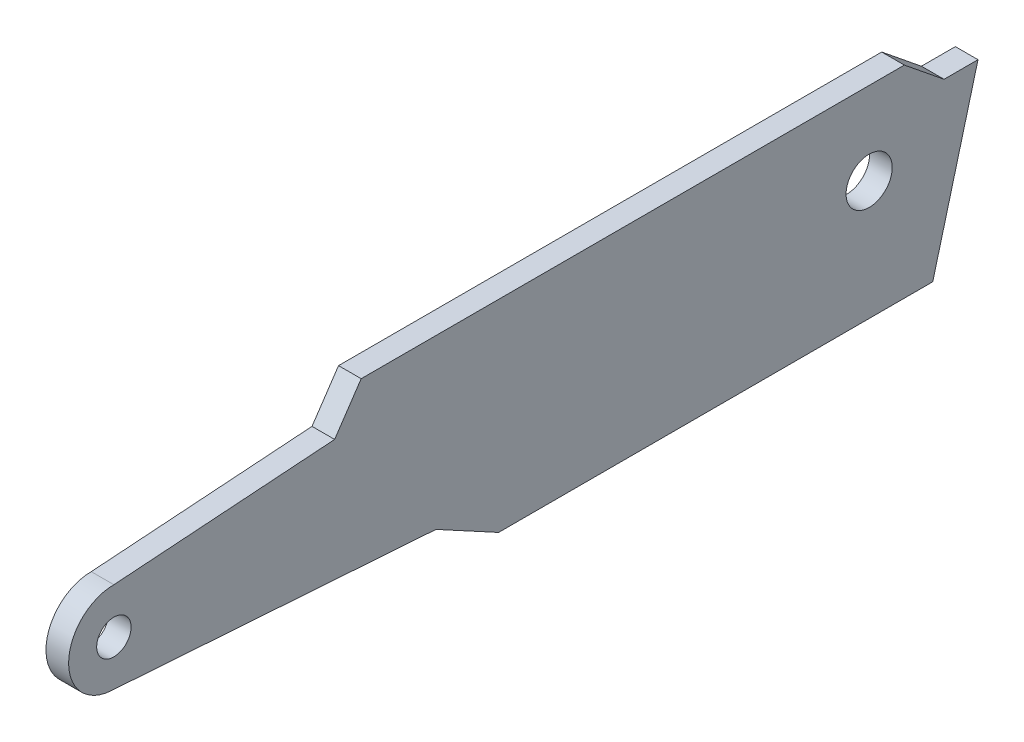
SolidWorks part; units mm, degrees
ref_plane "Front Plane" through (0, 0, 0) normal (0, 0, 1) x (1, 0, 0)
ref_plane "Top Plane" through (0, 0, 0) normal (0, 1, 0) x (1, 0, 0)
ref_plane "Right Plane" through (0, 0, 0) normal (1, 0, 0) x (0, 0, -1)
sketch "Sketch1" plane through (0, 0, 0) normal (1, 0, 0) x (0, 0, -1)
  line L0 (0, 0) -> (31.5689, 0) construction
  line L1 (0, 0) -> (0, 17.3829) construction
  line L2 (0, 6.35) -> (30.9687, 8.5155)
  line L3 (-0.443, -6.3345) -> (45.1829, -9.525)
  line L4 (30.9687, 8.5155) -> (34.6906, 14.0335)
  line L5 (34.6906, 14.0335) -> (110.8906, 14.0335)
  line L6 (110.8906, 14.0335) -> (116.459, 9.525)
  line L7 (116.459, 9.525) -> (121.2215, 9.525)
  line L8 (121.2215, 9.525) -> (114.8715, -14.2875)
  line L9 (114.8715, -14.2875) -> (53.975, -14.2875)
  line L10 (53.975, -14.2875) -> (45.1829, -9.525)
  circle A0 centre (0, 0) radius 2.413
  arc A1 (0, 6.35) -> (0, -6.35) centre (0, 0) ccw
  dimension "D1" = 4.826
  dimension "D2" = 12.7
  dimension "D3" = 4
  dimension "D4" = 34
  dimension "D5" = 14.2875
  dimension "D6" = 14.0335
  dimension "D7" = 9.525
  dimension "D8" = 4.7625
  dimension "D9" = 53.975
  dimension "D10" = 114.8715
  dimension "D11" = 121.2215
  dimension "D12" = 4.7625
  dimension "D13" = 4
  dimension "D14" = 76.2
  dimension "D15" = 7.1647
extrude "Boss-Extrude1" add sketch "Sketch1" along normal mid plane 3.175
sketch "Sketch2" plane through (1.5875, 0, 0) normal (1, 0, 0) x (0, 0, -1)
  circle A2 centre (105.9518, 2.4435) radius 3.2385
  dimension "D1" = 6.477
  dimension "D2" = 16.731
  dimension "D3" = 8.9197
extrude "Cut-Extrude1" cut sketch "Sketch2" against normal through all
